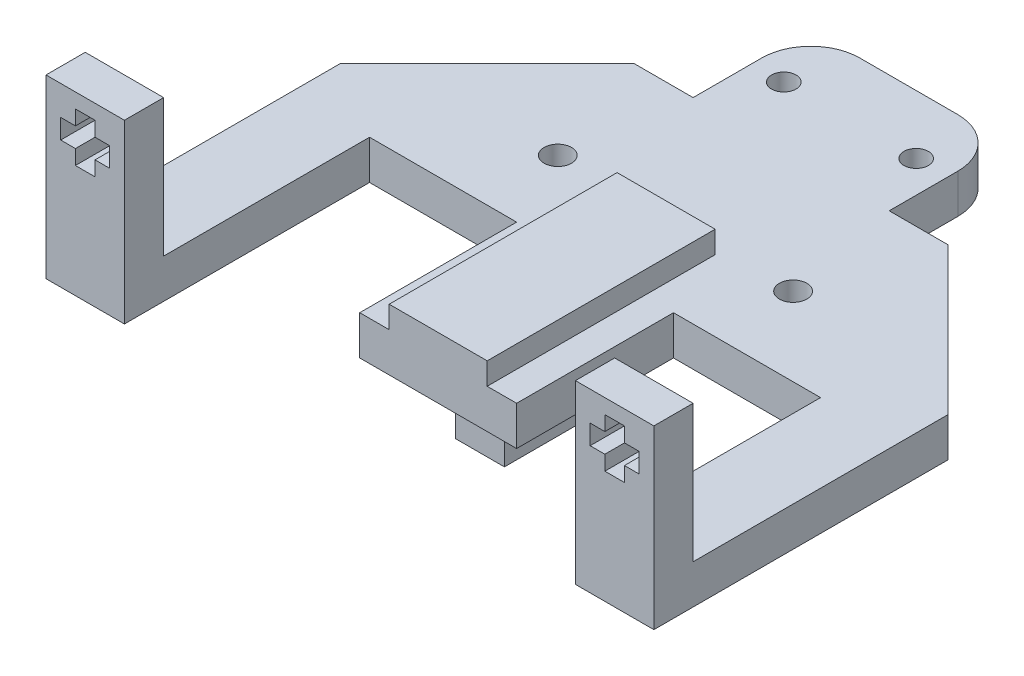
SolidWorks part; units mm, degrees
ref_plane "Front Plane" through (0, 0, 0) normal (0, 0, 1) x (1, 0, 0)
ref_plane "Top Plane" through (0, 0, 0) normal (0, 1, 0) x (1, 0, 0)
ref_plane "Right Plane" through (0, 0, 0) normal (1, 0, 0) x (0, 0, -1)
sketch "Sketch1" plane through (0, 0, 0) normal (0, 1, 0) x (1, 0, 0)
  line L0 (-12, 36) -> (-12, 0) construction
  line L1 (0, 0) -> (-24, 0)
  line L2 (0, 0) -> (0, 16)
  line L3 (0, 36) -> (-24, 36)
  line L4 (-24, 0) -> (-24, 16)
  line L5 (-24, 17.5) -> (0, 17.5) construction
  line L6 (0, 36) -> (0, 16) construction
  line L7 (0, 36) -> (19, 36)
  line L8 (-43, 16) -> (-43, -9)
  line L9 (0, 16) -> (11, 16)
  line L10 (19, 36) -> (19, 16)
  line L11 (-35, 16) -> (-35, -9)
  line L12 (-24, 16) -> (-35, 16)
  line L13 (-35, -9) -> (-43, -9)
  line L14 (-43, 36) -> (-43, 16)
  line L15 (-24, 36) -> (-43, 36)
  line L16 (19, 16) -> (19, -9)
  line L17 (19, -9) -> (11, -9)
  line L18 (11, 16) -> (11, -9)
  line L19 (-24, 36) -> (-24, 16) construction
  circle A0 centre (-6, 26.5) radius 2
  circle A1 centre (-6, 26.5) radius 2.6
  circle A2 centre (-6, 8.5) radius 2.6
  circle A3 centre (-6, 8.5) radius 2
  circle A4 centre (-18, 8.5) radius 2
  circle A5 centre (-18, 8.5) radius 2.6
  circle A6 centre (-18, 26.5) radius 2.6
  circle A7 centre (-18, 26.5) radius 2
  dimension "D3" = 6
  dimension "D5" = 4
  dimension "D6" = 5.2
  dimension "D1" = 24
  dimension "D2" = 36
  dimension "D4" = 8.5
  dimension "D7" = 20
  dimension "D8" = 19
  dimension "D9" = 8
  dimension "D11" = 25
  dimension "D12" = 9
extrude "Boss-Extrude1" add sketch "Sketch1" against normal blind 4
sketch "Sketch3" plane through (19, 0, 0) normal (1, 0, 0) x (0, 0, -1)
  line L1 (-9, 0) -> (-9, 14)
  line L2 (-5, 0) -> (-9, 0)
  line L3 (36, 0) -> (-9, 0) construction
  line L4 (-5, 0) -> (-5, 14)
  line L6 (-9, 14) -> (-5, 14)
  dimension "D1" = 4
  dimension "D2" = 14
extrude "Boss-Extrude6" add sketch "Sketch3" against normal blind 8
ref_plane "Plane1" through (-12, 0, 0) normal (1, 0, 0) x (0, 0, -1)
mirror "Mirror1" about plane through (-12, 0, 0) normal (1, 0, 0) of "Boss-Extrude6"
sketch "Sketch4" plane through (0, 0, 9) normal (0, 0, 1) x (1, 0, 0)
  line L0 (-40, 12.5) -> (-39, 12.5)
  line L1 (-39, 12.5) -> (-39, 10) construction
  line L2 (-39, 10) -> (-41.5, 10) construction
  line L3 (-41.5, 10) -> (-41.5, 11)
  line L4 (-41.5, 11) -> (-40, 11)
  line L5 (-40, 11) -> (-40, 12.5)
  line L6 (-39, 14) -> (-39, 12.5) construction
  line L7 (-35, 14) -> (-43, 14) construction
  line L8 (-39, 12.5) -> (-38, 12.5)
  line L9 (-38, 12.5) -> (-38, 11)
  line L10 (-38, 11) -> (-36.5, 11)
  line L11 (-36.5, 11) -> (-36.5, 10)
  line L12 (-36.5, 10) -> (-36.5, 9)
  line L13 (-36.5, 9) -> (-38, 9)
  line L14 (-38, 9) -> (-38, 7.5)
  line L15 (-38, 7.5) -> (-39, 7.5)
  line L16 (-39, 7.5) -> (-40, 7.5)
  line L17 (-40, 7.5) -> (-40, 9)
  line L18 (-40, 9) -> (-41.5, 9)
  line L19 (-41.5, 9) -> (-41.5, 10)
  line L20 (-35, 10) -> (11, 10) construction
  line L22 (11, -4) -> (11, 14) construction
  line L23 (-12, 14) -> (-12, 0) construction
  line L24 (0, 0) -> (-24, 0) construction
  line L25 (11, 14) -> (19, 14) construction
  line L26 (-35, -4) -> (-35, 14) construction
  line L28 (17.5, 9) -> (17.5, 10)
  line L29 (16, 9) -> (17.5, 9)
  line L30 (16, 7.5) -> (16, 9)
  line L31 (15, 7.5) -> (16, 7.5)
  line L32 (14, 7.5) -> (15, 7.5)
  line L33 (14, 9) -> (14, 7.5)
  line L34 (12.5, 9) -> (14, 9)
  line L35 (12.5, 10) -> (12.5, 9)
  line L36 (12.5, 11) -> (12.5, 10)
  line L37 (14, 11) -> (12.5, 11)
  line L38 (14, 12.5) -> (14, 11)
  line L39 (15, 12.5) -> (14, 12.5)
  line L40 (16, 11) -> (16, 12.5)
  line L41 (17.5, 11) -> (16, 11)
  line L42 (17.5, 10) -> (17.5, 11)
  line L43 (16, 12.5) -> (15, 12.5)
  point P27 (-39, 10)
  point P32 (-12, 10)
  dimension "D1" = 1
  dimension "D2" = 1.5
  dimension "D3" = 1.5
  dimension "D4" = 1
  dimension "D5" = 1.5
  dimension "D6" = 4
extrude "Cut-Extrude1" cut sketch "Sketch4" against normal up to next contours L19 L18 L17 L16 L15 L14 L13 L12 L11 L10 L9 L8 L0 L5 L4 L3 | L40 L43 L39 L38 L37 L36 L35 L34 L33 L32 L31 L30 L29 L28 L42 L41
sketch "Sketch5" plane through (0, 0, 0) normal (0, 1, 0) x (1, 0, 0)
  line L1 (-22, 48) -> (-2, 48)
  line L2 (-22, 48) -> (-22, 33)
  line L3 (-22, 33) -> (-2, 33)
  line L4 (-2, 48) -> (-2, 33)
  line L5 (-12, 26.5) -> (-12, 48) construction
  line L6 (-43, 36) -> (19, 36) construction
  line L7 (-2, 42) -> (-22, 42) construction
  circle A3 centre (-18.75, 42) radius 1.25
  circle A4 centre (-5.25, 42) radius 1.25
  dimension "D5" = 6.75
  dimension "D6" = 2.5
  dimension "D1" = 20
  dimension "D2" = 12
  dimension "D3" = 3
  dimension "D4" = 6
extrude "Boss-Extrude7" add sketch "Sketch5" against normal blind 4
fillet "Fillet1" radius 5 2 edges at (-2, -2, -48) (-22, -2, -48)
chamfer "Chamfer1" distance 15 angle 45 2 edges at (19, -2, -36) (-43, -2, -36)
sketch "Sketch6" plane through (0, 0, 0) normal (0, 1, 0) x (1, 0, 0)
  line L0 (0, 0) -> (-24, 0) construction
  line L1 (-24, 16) -> (-20, 16)
  line L2 (-24, 16) -> (-24, 0)
  line L3 (-24, 0) -> (-20, 0)
  line L4 (-20, 16) -> (-20, 0)
  dimension "D1" = 4
extrude "Cut-Extrude2" cut sketch "Sketch6" against normal blind 10
sketch "Sketch7" plane through (0, 0, 0) normal (0, 1, 0) x (1, 0, 0)
  line L0 (0, 0) -> (-20, 0) construction
  line L1 (0, 16) -> (-4, 16)
  line L2 (0, 16) -> (0, 0)
  line L3 (0, 0) -> (-4, 0)
  line L4 (-4, 16) -> (-4, 0)
  dimension "D1" = 4
extrude "Cut-Extrude3" cut sketch "Sketch7" against normal blind 10
sketch "Sketch8" plane through (0, 0, 0) normal (0, 1, 0) x (1, 0, 0)
  line L0 (-4, 0) -> (-20, 0) construction
  line L1 (-17, 0) -> (-7, 0)
  line L2 (-17, 0) -> (-17, 23.2484)
  line L3 (-17, 23.2484) -> (-7, 23.2484)
  line L4 (-7, 0) -> (-7, 23.2484)
  line L5 (-20, 0) -> (-20, 16) construction
  line L6 (-4, 16) -> (-4, 0) construction
  dimension "D1" = 3
  dimension "D2" = 3
extrude "Boss-Extrude8" add sketch "Sketch8" along normal blind 2.25
sketch "Sketch9" plane through (0, 0, 0) normal (0, 1, 0) x (1, 0, 0)
  line L2 (-28, 36) -> (-22, 36) construction
  circle A0 centre (-23.8, 24) radius 1.4
  circle A1 centre (0.2, 24) radius 1.4
  dimension "D1" = 12
  dimension "D3" = 2
  dimension "D2" = 19.2
extrude "Cut-Extrude4" cut sketch "Sketch9" against normal blind 3
sketch "Sketch10" plane through (0, -4, 6) normal (0, -1, 0) x (-1, 0, 0)
  line L1 (12, 16) -> (17, 16)
  line L2 (12, 16) -> (12, 12.755)
  line L3 (12, 12.755) -> (17, 12.755)
  line L4 (17, 16) -> (17, 12.755)
  dimension "D1" = 5
extrude "Boss-Extrude9" add sketch "Sketch10" along normal blind 9 and the other way blind 4
sketch "Sketch11" plane through (0, -13, 6) normal (0, -1, 0) x (-1, 0, 0)
  line L1 (12, 14.0819) -> (17, 14.0819)
  line L2 (12, 14.0819) -> (12, 22.0819)
  line L3 (12, 22.0819) -> (17, 22.0819)
  line L4 (17, 14.0819) -> (17, 22.0819)
  dimension "D1" = 8
  dimension "D2" = 5
extrude "Boss-Extrude10" add sketch "Sketch11" against normal blind 4
ref_plane "Plane2" through (-17, -9, -10) normal (0, 1, 0) x (1, 0, 0)
sketch "Sketch14" plane through (0, -4, 0) normal (0, -1, 0) x (-1, 0, 0)
  line L1 (-0.0335, 30.0379) -> (-3.0335, 30.0379)
  line L2 (-0.0335, 30.0379) -> (-0.0335, 25.0379)
  line L3 (-0.0335, 25.0379) -> (-3.0335, 25.0379)
  line L4 (-3.0335, 30.0379) -> (-3.0335, 25.0379)
  dimension "D1" = 3
  dimension "D2" = 5
extrude "Boss-Extrude13" add sketch "Sketch14" along normal blind 9
sketch "Sketch15" plane through (0, -13, 0) normal (0, -1, 0) x (-1, 0, 0)
  line L1 (-3.0335, 30.0379) -> (4.9665, 30.0379)
  line L2 (-3.0335, 30.0379) -> (-3.0335, 25.0379)
  line L3 (-3.0335, 25.0379) -> (4.9665, 25.0379)
  line L4 (4.9665, 30.0379) -> (4.9665, 25.0379)
  dimension "D1" = 8
extrude "Boss-Extrude14" add sketch "Sketch15" against normal blind 4
